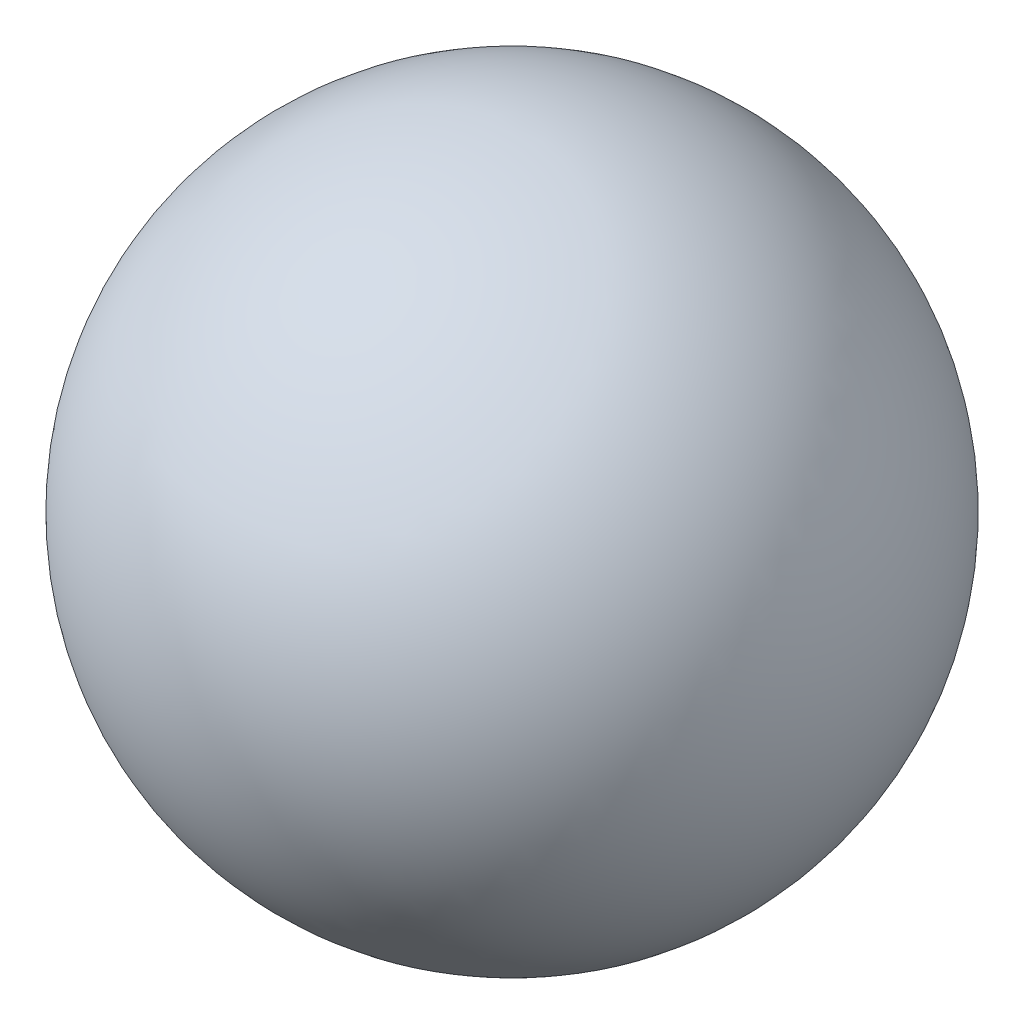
SolidWorks part; units mm, degrees
ref_plane "Přední" through (0, 0, 0) normal (0, 0, 1) x (1, 0, 0)
ref_plane "Horní" through (0, 0, 0) normal (0, 1, 0) x (1, 0, 0)
ref_plane "Pravá" through (0, 0, 0) normal (1, 0, 0) x (0, 0, -1)
sketch "Skica1" plane through (0, 0, 0) normal (0, 0, 1) x (1, 0, 0)
  line L0 (0, 86.25) -> (0, -86.25)
  arc A0 (0, 86.25) -> (0, -86.25) centre (0, 0) ccw
  dimension "D1" = 86.25
revolve "Otočit kolem osy1" add sketch "Skica1" angle 360 about L0
sketch "Skica2" plane through (0, 0, 0) normal (0, 0, 1) x (1, 0, 0)
  point P0 (0, 47.6765)
ref_plane "Rovina1" through (0, 47.6765, 0) normal (0, 1, 0) x (-1, 0, 0)
